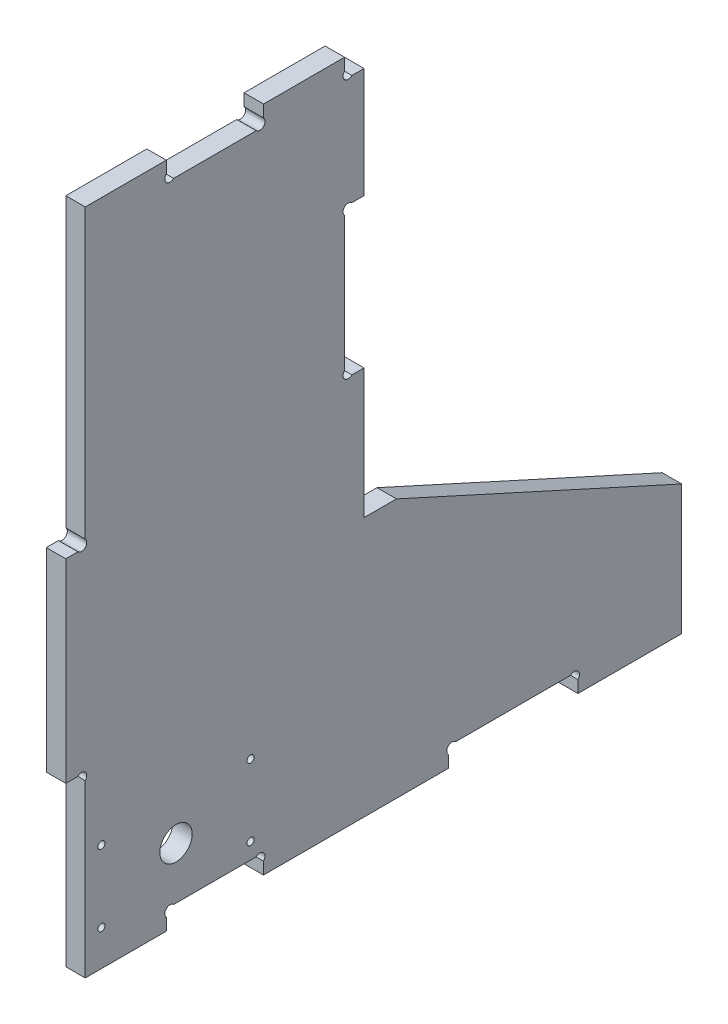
SolidWorks part; units mm, degrees
ref_plane "Plan de face" through (0, 0, 0) normal (0, 0, 1) x (1, 0, 0)
ref_plane "Plan de dessus" through (0, 0, 0) normal (0, 1, 0) x (1, 0, 0)
ref_plane "Plan de droite" through (0, 0, 0) normal (1, 0, 0) x (0, 0, -1)
sketch "Esquisse1" plane through (0, 0, 0) normal (1, 0, 0) x (0, 0, -1)
  line L0 (0, -10.3129) -> (0, 307.1625) construction
  line L1 (-27.1936, 0) -> (271.4753, 0) construction
  line L2 (190, -20.9884) -> (190, 307.1625) construction
  line L3 (-42.7575, 206) -> (249.2826, 206) construction
  line L4 (6, -10.3129) -> (6, 221.4171) construction
  line L5 (86, 221.4171) -> (86, -10.3129) construction
  line L6 (92, 293.1632) -> (92, -10.3129) construction
  line L7 (-27.1936, 85) -> (18.5, 85) construction
  line L8 (46, 217.6024) -> (46, 164.2536) construction
  line L9 (-14.9402, 55) -> (18.5, 55) construction
  line L10 (6, 55) -> (-12.1466, 36.8534) construction
  line L11 (229.549, 80) -> (68.0786, 80) construction
  line L12 (222.2517, 40) -> (177.5556, 40) construction
  line L13 (-27.1936, 270) -> (271.4753, 270) construction
  line L14 (86, 166) -> (107.8987, 144.1013) construction
  line L15 (102, 70.0066) -> (102, 120.1705) construction
  line L16 (190, 40) -> (102, 80)
  line L17 (3.7373, 115) -> (0, 115)
  line L18 (0, 115) -> (0, 55)
  line L19 (0, 55) -> (3.7373, 55)
  line L20 (138, -20.9884) -> (138, 65) construction
  line L21 (214.0422, 6) -> (-14.9402, 6) construction
  line L22 (-27.1936, 200) -> (96.2119, 200) construction
  line L23 (-42.7575, 103) -> (34.1305, 103) construction
  line L24 (61, 196.9035) -> (61, 217.6024) construction
  line L25 (61, 200) -> (49.322, 211.678) construction
  line L28 (31, 202.2627) -> (31, 206)
  line L29 (33.2627, 200) -> (58.7373, 200)
  line L30 (61, 202.2627) -> (61, 206)
  line L31 (61, 3.7373) -> (61, 0)
  line L32 (33.2627, 6) -> (58.7373, 6)
  line L33 (31, 3.7373) -> (31, 0)
  line L34 (6, 52.7373) -> (6, 0)
  line L35 (6, 0) -> (31, 0)
  line L36 (6, 117.2627) -> (6, 206)
  line L37 (6, 206) -> (31, 206)
  line L38 (61, 206) -> (86, 206)
  line L40 (88.2627, 166) -> (92, 166)
  line L41 (88.2627, 120) -> (92, 120)
  line L42 (92, 80) -> (102, 80)
  line L43 (144.8523, 143) -> (73.5, 143) construction
  line L44 (158, 15.2014) -> (158, -20.9884) construction
  line L45 (158, 6) -> (141.9345, -10.0655) construction
  line L46 (122.5619, 166) -> (80.6919, 166) construction
  line L47 (86, 163.7373) -> (86, 122.2627)
  line L50 (92, 200) -> (92, 166)
  line L51 (92, 120) -> (92, 80)
  line L52 (190, 40) -> (190, 0)
  line L53 (86, 200) -> (96.9748, 210.9748) construction
  line L54 (86, 206) -> (86, 202.2627)
  line L55 (190, 0) -> (158, 0)
  line L56 (158, 3.7373) -> (158, 0)
  line L57 (120.2627, 6) -> (155.7373, 6)
  line L58 (118, 3.7373) -> (118, 0)
  line L59 (61, 0) -> (118, 0)
  line L60 (88.2627, 200) -> (92, 200)
  line L62 (59.12, 22) -> (29.0024, 22) construction
  line L63 (7, 7) -> (61, 7) construction
  line L64 (7, 7) -> (7, 37) construction
  line L65 (7, 37) -> (61, 37) construction
  line L66 (61, 7) -> (61, 37) construction
  line L67 (7, 7) -> (61, 37) construction
  line L68 (7, 37) -> (61, 7) construction
  line L69 (34, 3.8221) -> (34, 25.7828) construction
  line L70 (11, 12.0221) -> (11, 21.9555) construction
  line L71 (9.9397, 11) -> (21.9867, 11) construction
  arc A0 (6, 52.7373) -> (3.7373, 55) centre (4.8686, 53.8686) ccw
  arc A1 (6, 117.2627) -> (3.7373, 115) centre (4.8686, 116.1314) cw
  arc A2 (58.7373, 200) -> (61, 202.2627) centre (59.8686, 201.1314) ccw
  arc A4 (33.2627, 200) -> (31, 202.2627) centre (32.1314, 201.1314) cw
  arc A7 (33.2627, 6) -> (31, 3.7373) centre (32.1314, 4.8686) ccw
  circle A8 centre (11, 11) radius 1.1
  arc A9 (58.7373, 6) -> (61, 3.7373) centre (59.8686, 4.8686) cw
  arc A10 (88.2627, 166) -> (86, 163.7373) centre (87.1314, 164.8686) ccw
  circle A11 centre (57, 11) radius 1.1
  circle A12 centre (57, 33) radius 1.1
  arc A13 (158, 3.7373) -> (155.7373, 6) centre (156.8686, 4.8686) ccw
  circle A14 centre (11, 33) radius 1.1
  arc A15 (118, 3.7373) -> (120.2627, 6) centre (119.1314, 4.8686) cw
  arc A16 (88.2627, 120) -> (86, 122.2627) centre (87.1314, 121.1314) cw
  arc A17 (86, 202.2627) -> (88.2627, 200) centre (87.1314, 201.1314) ccw
  circle A22 centre (34, 22) radius 5
  point P131 (34, 22)
  dimension "D15" = 6
  dimension "D23" = 63
  dimension "D32" = 1
  dimension "D35" = 4
  dimension "D24" = 23
  dimension "D30" = 45
  dimension "D31" = 1
  dimension "D1" = 206
  dimension "D2" = 190
  dimension "D3" = 6
  dimension "D4" = 6
  dimension "D5" = 80
  dimension "D6" = 85
  dimension "D7" = 30
  dimension "D8" = 45
  dimension "D9" = 40
  dimension "D10" = 80
  dimension "D11" = 40
  dimension "D12" = 270
  dimension "D13" = 10
  dimension "D14" = 45
  dimension "D16" = 46
  dimension "D17" = 6
  dimension "D18" = 103
  dimension "D19" = 15
  dimension "D20" = 45
  dimension "D26" = 45
  dimension "D27" = 20
  dimension "D34" = 4
extrude "Boss.-Extru.1" add sketch "Esquisse1" along normal blind 6
